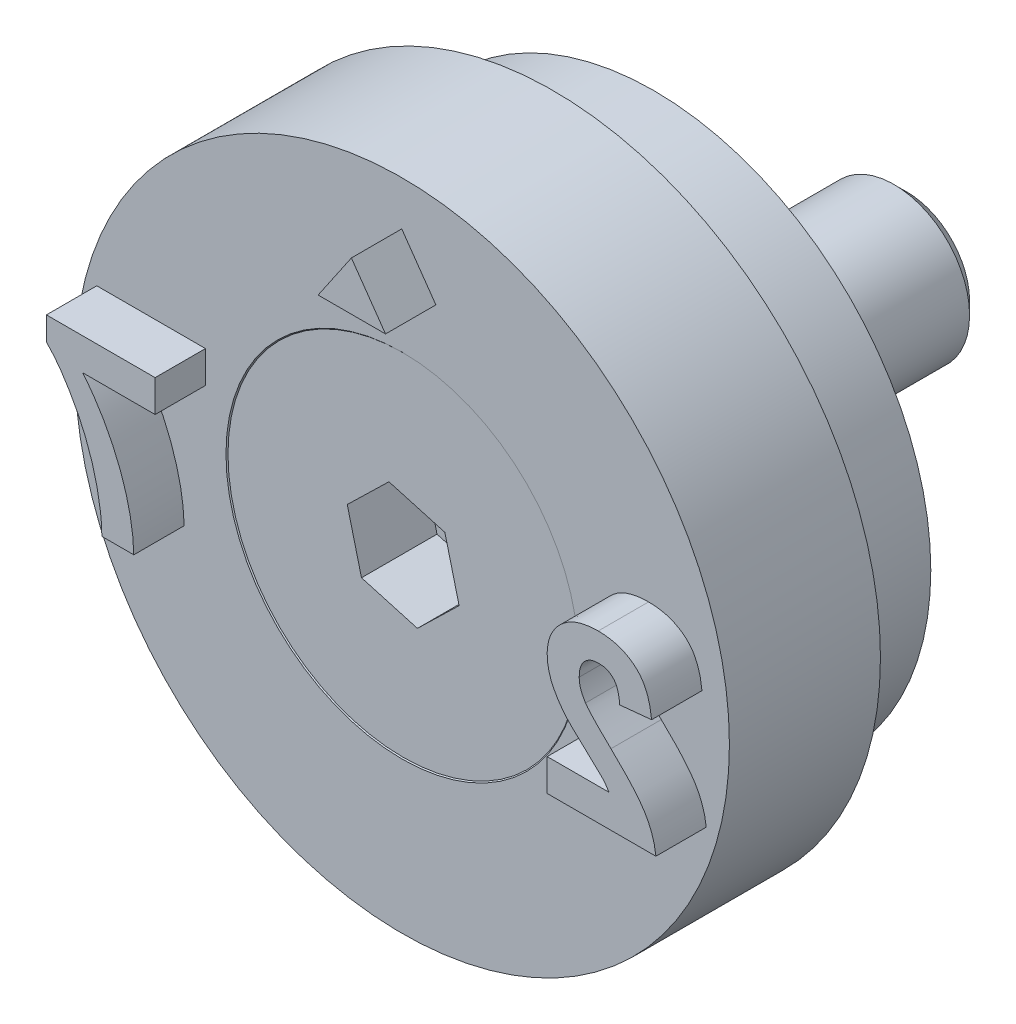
SolidWorks part; units mm, degrees
other "<M3 X .5 FHCS>-<Imported1>"
ref_plane "Front Plane" through (0, 0, 0) normal (0, 0, 1) x (1, 0, 0)
ref_plane "Top Plane" through (0, 0, 0) normal (0, 1, 0) x (1, 0, 0)
ref_plane "Right Plane" through (0, 0, 0) normal (1, 0, 0) x (0, 0, -1)
imported_body "Imported1"
other "DeleteFace1"
sketch "Sketch1" plane through (0, 0, 0) normal (0, 0, 1) x (1, 0, 0)
  line L0 (-0.0087, 5.6166) -> (-0.6694, 4.6482)
  line L1 (-0.6694, 4.6482) -> (0.6694, 4.6482)
  line L2 (0.6694, 4.6482) -> (-0.0087, 5.6166)
  text T0 "2      7" font "Arial" height 3.302
  dimension "D1" = 1.651
extrude "Boss-Extrude1" add sketch "Sketch1" along normal blind 1
inserted part "M3 X .5 FHCS"
move or copy body "Body-Move/Copy2" placed by mates yes
